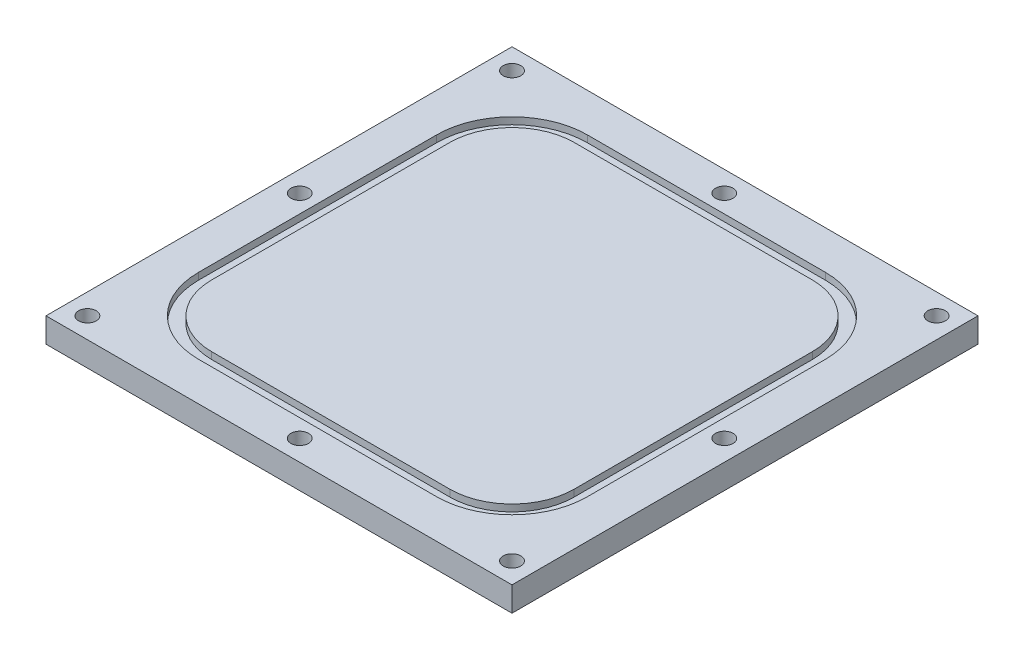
SolidWorks part; units mm, degrees
ref_plane "Front Plane" through (0, 0, 0) normal (0, 0, 1) x (1, 0, 0)
ref_plane "Top Plane" through (0, 0, 0) normal (0, 1, 0) x (1, 0, 0)
ref_plane "Right Plane" through (0, 0, 0) normal (1, 0, 0) x (0, 0, -1)
sketch "Sketch1" plane through (0, 0, 0) normal (0, 1, 0) x (1, 0, 0)
  line L1 (-45, -45) -> (45, -45)
  line L2 (-45, -45) -> (-45, 45)
  line L3 (-45, 45) -> (45, 45)
  line L4 (45, -45) -> (45, 45)
  line L5 (-45, -45) -> (45, 45) construction
  line L6 (-45, 45) -> (45, -45) construction
  point P0 (0, 0)
  dimension "D1" = 90
extrude "Boss-Extrude1" add sketch "Sketch1" along normal blind 4.7498
hole_wizard "Ø3.4 (3.4) Diameter Hole1" positions "Sketch8" profile "Sketch7" hole size "Ø3.4" standard "Ansi Metric"
sketch "Sketch8" plane through (0, 0, 0) normal (0, -1, 0) x (1, 0, 0)
  line L0 (-45, -45) -> (-45, 45) construction
  line L1 (45, 45) -> (45, -45) construction
  line L2 (-45, 45) -> (45, 45) construction
  line L3 (45, -45) -> (-45, -45) construction
  point P0 (-41, 41)
  point P1 (0, 41)
  point P3 (41, 41)
  point P5 (41, 0)
  point P7 (41, -41)
  point P9 (0, -41)
  point P11 (-41, -41)
  point P13 (-41, 0)
  dimension "D1" = 4
  dimension "D2" = 4
  dimension "D3" = 4
  dimension "D4" = 4
sketch "Sketch7" plane through (-41, 0, 41) normal (1, 0, 0) x (0, 0, -1)
  line L0 (0, 0) -> (0, 4.7498)
  line L1 (0, 4.7498) -> (1.7, 4.7498)
  line L2 (1.7, 4.7498) -> (1.7, 0)
  line L5 (1.7, 0) -> (0, 0)
  line L11 (0, -6.35) -> (0, 107.95) construction
  dimension "Thru Hole Dia." = 3.4
  dimension "Thru Hole Depth" = 4.7498
sketch "Sketch9" plane through (0, 4.7498, 0) normal (0, 1, 0) x (1, 0, 0)
  line L0 (23, -37.54) -> (-23, -37.54)
  line L1 (23, -35) -> (-23, -35)
  line L2 (35, -23) -> (35, 23)
  line L3 (23, 35) -> (-23, 35)
  line L4 (-35, -23) -> (-35, 23)
  line L5 (-37.54, -23) -> (-37.54, 23)
  line L6 (23, 37.54) -> (-23, 37.54)
  line L7 (37.54, -23) -> (37.54, 23)
  arc A0 (23, -35) -> (35, -23) centre (23, -23) ccw
  arc A1 (-35, -23) -> (-23, -35) centre (-23, -23) ccw
  arc A2 (35, 23) -> (23, 35) centre (23, 23) ccw
  arc A3 (-23, 35) -> (-35, 23) centre (-23, 23) ccw
  arc A4 (-37.54, -23) -> (-23, -37.54) centre (-23, -23) ccw
  arc A5 (-23, 37.54) -> (-37.54, 23) centre (-23, 23) ccw
  arc A6 (37.54, 23) -> (23, 37.54) centre (23, 23) ccw
  arc A7 (23, -37.54) -> (37.54, -23) centre (23, -23) ccw
  dimension "D5" = 24
  dimension "D1" = 35
  dimension "D2" = 70
  dimension "D3" = 35
  dimension "D4" = 70
  dimension "D6" = 2.54
extrude "Cut-Extrude2" cut sketch "Sketch9" against normal blind 1.3208
